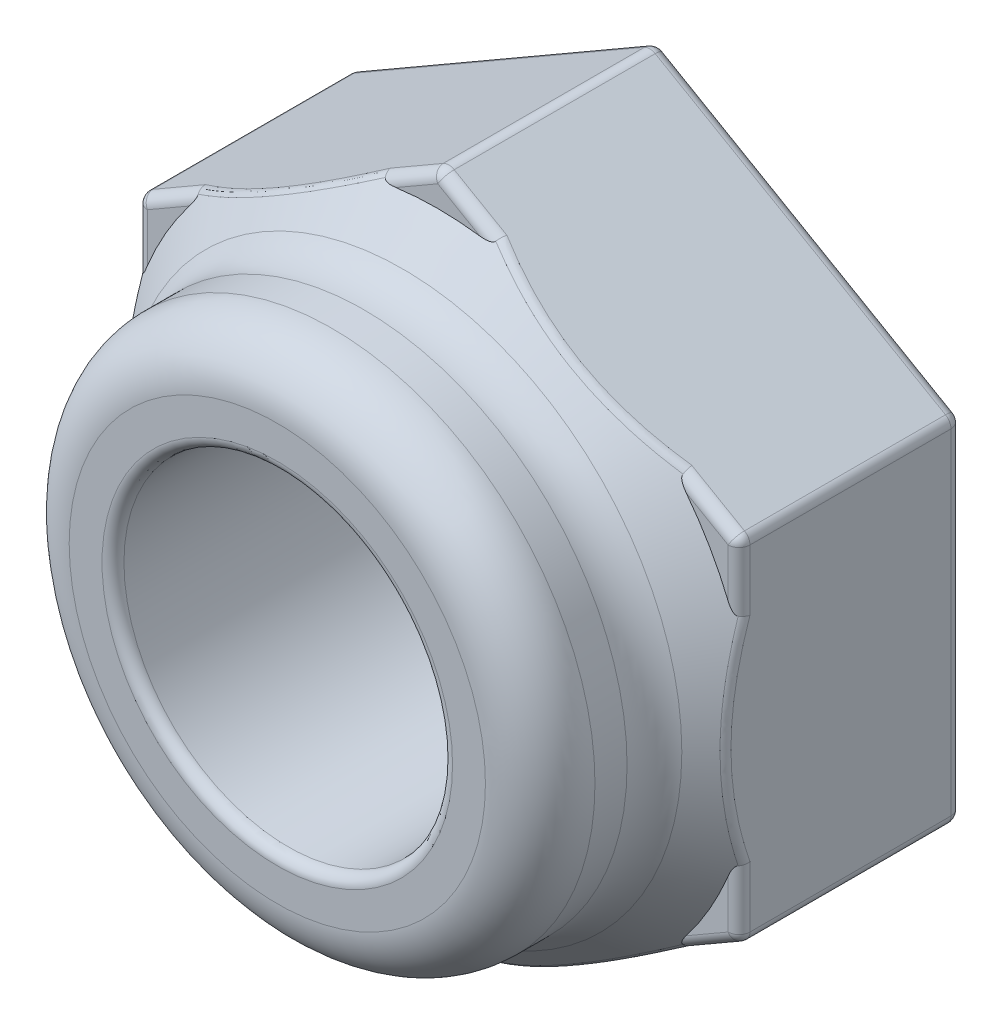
SolidWorks part; units mm, degrees
ref_plane "Plan1" through (0, 0, 0) normal (0, 0, 1) x (1, 0, 0)
ref_plane "Plan2" through (0, 0, 0) normal (0, 1, 0) x (1, 0, 0)
ref_plane "Plan3" through (0, 0, 0) normal (1, 0, 0) x (0, 0, -1)
sketch "Esquisse1" plane through (0, 0, 0) normal (0, 0, 1) x (1, 0, 0)
  line L1 (0, 3.1754) -> (-2.75, 1.5877)
  line L2 (-2.75, 1.5877) -> (-2.75, -1.5877)
  line L3 (-2.75, -1.5877) -> (0, -3.1754)
  line L4 (0, -3.1754) -> (2.75, -1.5877)
  line L5 (2.75, -1.5877) -> (2.75, 1.5877)
  line L6 (2.75, 1.5877) -> (0, 3.1754)
  circle A0 centre (0, 0) radius 2.75 construction
  dimension "D1" = 5.5
extrude "Extrusion1" add sketch "Esquisse1" along normal blind 2.5
sketch "Esquisse2" plane through (0, 0, 0) normal (0, 1, 0) x (1, 0, 0)
  line L0 (0, 0) -> (0, -4.0296) construction
  line L1 (2.4, -2.5) -> (2.865, -2.035)
  line L2 (2.865, -2.035) -> (4.1264, -2.035)
  line L3 (4.1264, -2.035) -> (4.1264, -2.5)
  line L4 (4.1264, -2.5) -> (2.4, -2.5)
  line L5 (2.75, -2.5) -> (0, -2.5) construction
  dimension "D1" = 45
  dimension "D2" = 2.4
revolve "Enlèvement de matière-Révolution1" cut sketch "Esquisse2" angle 360 about L0
sketch "Esquisse3" plane through (0, 0, 2.5) normal (0, 0, 1) x (1, 0, 0)
  circle A1 centre (0, 0) radius 2.4
  circle A2 centre (0, 0) radius 2.4
  dimension "D1" = 0
extrude "Extrusion2" add sketch "Esquisse3" along normal blind 1
fillet "Congé1" radius 0.5
hole_wizard "Trou taraudé M3x0.51" positions "Esquisse5" profile "Esquisse4" tap size "M3x0.5" standard "ISO"
sketch "Esquisse5" plane through (0, 0, 3.5) normal (0, 0, 1) x (1, 0, 0)
  circle A0 centre (0, 0) radius 1.9 construction
  point P0 (0, 0)
sketch "Esquisse4" plane through (0, 0, 3.5) normal (1, 0, 0) x (0, -1, 0)
  line L0 (0, 0) -> (0, 9.2511)
  line L1 (0, 9.2511) -> (1.25, 8.5)
  line L2 (1.25, 8.5) -> (1.25, 6)
  line L3 (1.25, 6) -> (1.5, 6)
  line L4 (1.5, 6) -> (1.5, 0)
  line L5 (1.5, 0) -> (0, 0)
  line L10 (0, 9.2511) -> (-1.25, 8.5) construction
  line L11 (0, -6.35) -> (0, 107.95) construction
  dimension "Diamètre du trou pour taraudage" = 2.5
  dimension "Profondeur du trou pour taraudage" = 8.5
  dimension "Diamètre principal du filetage" = 3
  dimension "Profondeur du filetage" = 6
  dimension "Angle de pointe" = 118
fillet "Congé2" radius 0.1
